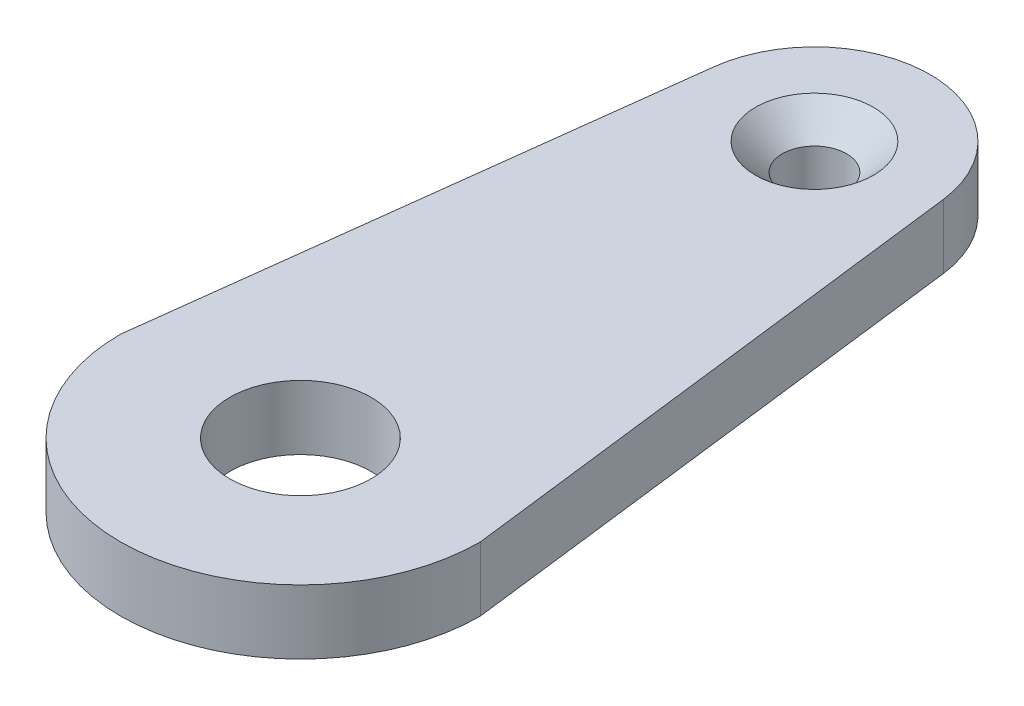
SolidWorks part; units mm, degrees
ref_plane "Front Plane" through (0, 0, 0) normal (0, 0, 1) x (1, 0, 0)
ref_plane "Top Plane" through (0, 0, 0) normal (0, 1, 0) x (1, 0, 0)
ref_plane "Right Plane" through (0, 0, 0) normal (1, 0, 0) x (0, 0, -1)
sketch "Sketch1" plane through (0, 0, 0) normal (0, 1, 0) x (1, 0, 0)
  line L0 (0, 0) -> (0, 40) construction
  line L1 (-14, 0) -> (-14, 40)
  line L2 (14, 0) -> (14, 40)
  arc A0 (-14, 0) -> (14, 0) centre (0, 0) ccw
  arc A1 (14, 40) -> (-14, 40) centre (0, 40) ccw
  circle A2 centre (0, 40) radius 2.5
  circle A3 centre (0, 0) radius 5.5
  point P3 (0, 20)
  dimension "D3" = 11
  dimension "D4" = 5
  dimension "D1" = 40
  dimension "D2" = 28
extrude "Boss-Extrude1" add sketch "Sketch1" along normal blind 5
sketch "Sketch3" plane through (0, 5, 0) normal (0, 1, 0) x (1, 0, 0)
  line L0 (-14, 0) -> (-8.9324, 41.1013)
  line L1 (14, 0) -> (8.9324, 41.1013)
  line L2 (-14, 40) -> (-14, 0) construction
  line L3 (14, 0) -> (14, 40) construction
  line L4 (-14, 40) -> (-14, 0)
  line L5 (14, 0) -> (14, 40)
  arc A1 (14, 40) -> (-14, 40) centre (0, 40) ccw construction
  circle A3 centre (0, 40) radius 9
  arc A4 (14, 40) -> (-14, 40) centre (0, 40) ccw
  dimension "D1" = 18
extrude "Cut-Extrude2" cut sketch "Sketch3" against normal through all contours A3 L1 L0 M12 M13 M14
hole_wizard "CSK for M4 Hex Socket Countersunk Head Screw2" positions "Sketch6" profile "Sketch5" countersink size "M4" standard "DIN"
sketch "Sketch6" plane through (0, 5, 0) normal (0, 1, 0) x (1, 0, 0)
  point P0 (0, 40)
sketch "Sketch5" plane through (0, 5, -40) normal (1, 0, 0) x (0, 0, 1)
  line L0 (0, 0) -> (0, 5)
  line L1 (0, 5) -> (2.25, 5)
  line L2 (2.25, 5) -> (2.25, 2.34)
  line L3 (2.25, 2.34) -> (4.59, 0)
  line L5 (4.59, 0) -> (0, 0)
  line L6 (-2.25, 2.34) -> (-4.59, 0) construction
  line L11 (0, -6.35) -> (0, 107.95) construction
  dimension "Thru Hole Dia." = 4.5
  dimension "Thru Hole Depth" = 5
  dimension "Near C'Sink Dia." = 9.18
  dimension "Near C'Sink Angle" = 90
